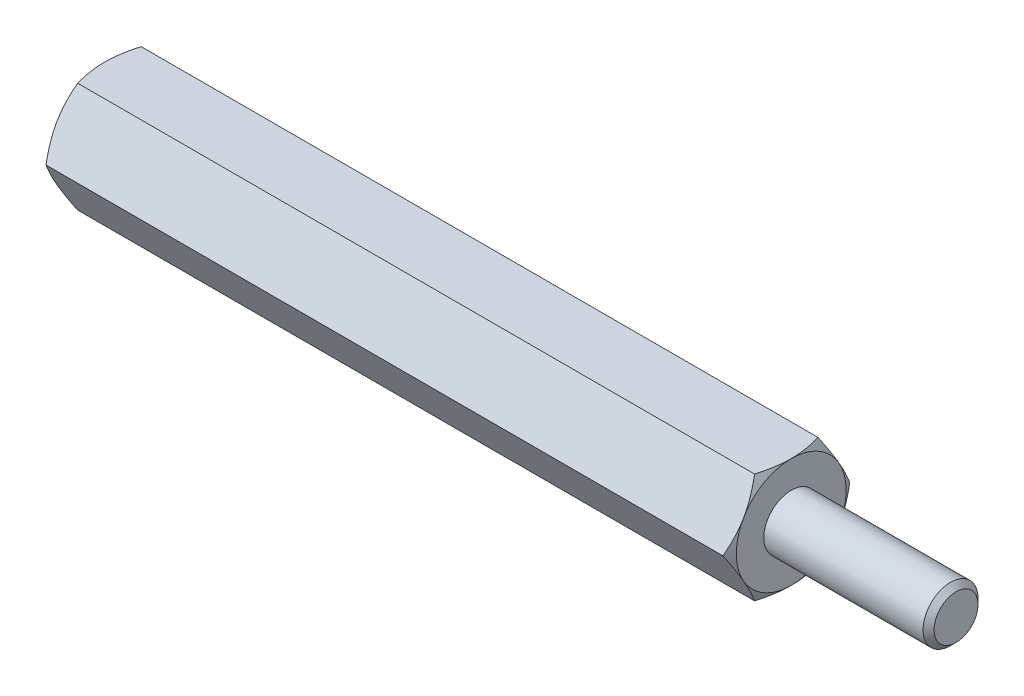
SolidWorks part; units mm, degrees
ref_plane "Front Plane" through (0, 0, 0) normal (0, 0, 1) x (1, 0, 0)
ref_plane "Top Plane" through (0, 0, 0) normal (0, 1, 0) x (1, 0, 0)
ref_plane "Right Plane" through (0, 0, 0) normal (1, 0, 0) x (0, 0, -1)
sketch "Sketch1" plane through (0, 0, 0) normal (1, 0, 0) x (0, 0, -1)
  line L1 (1.1547, 2) -> (-1.1547, 2)
  line L2 (-1.1547, 2) -> (-2.3094, 0)
  line L3 (-2.3094, 0) -> (-1.1547, -2)
  line L4 (-1.1547, -2) -> (1.1547, -2)
  line L5 (1.1547, -2) -> (2.3094, 0)
  line L6 (2.3094, 0) -> (1.1547, 2)
  circle A0 centre (0, 0) radius 2 construction
  dimension "D1" = 4
extrude "Extrude2" add sketch "Sketch1" along normal mid plane 25
sketch "Sketch2" plane through (0, 0, 0) normal (0, 0, 1) x (1, 0, 0)
  line L0 (-12.5, 2) -> (-11, 4.5981)
  line L1 (-12.5, 5) -> (-12.5, 2)
  line L3 (0, 0) -> (50000, 0) construction
  arc A0 (-11, 4.5981) -> (-12.5, 5) centre (-11.6962, 5) ccw
  dimension "D1" = 30
  dimension "D2" = 3
revolve "Cut-Revolve1" cut sketch "Sketch2" angle 360 about L3
mirror "Mirror1" about plane through (0, 0, 0) normal (1, 0, 0) of "Cut-Revolve1"
sketch "Sketch3" plane through (-12.5, 0, 0) normal (-1, 0, 0) x (0, 0, 1)
  circle A0 centre (0, 0) radius 0.8
  dimension "D1" = 1.6
extrude "Extrude3" cut sketch "Sketch3" against normal blind 6
sketch "Sketch4" plane through (0, 0, 0) normal (0, 0, 1) x (1, 0, 0)
  line L0 (-6.5, 0) -> (-6.5, 0.8)
  line L1 (12.3214, 0) -> (-12.3214, 0) construction
  line L2 (-6.5, 0.8) -> (-6.0381, 0)
  line L3 (-6.0381, 0) -> (-6.5, 0)
  line L4 (-12.5, 1) -> (-12.5, -1) construction
  point P4 (-12.5, 0)
  dimension "D1" = 30
  dimension "D2" = 0.8
  dimension "D3" = 6
revolve "Cut-Revolve2" cut sketch "Sketch4" angle 360 about L3
sketch "Sketch5" plane through (12.5, 0, 0) normal (1, 0, 0) x (0, 0, -1)
  circle A0 centre (0, 0) radius 1
  dimension "D1" = 2
extrude "Extrude4" add sketch "Sketch5" along normal blind 6
chamfer "Chamfer1" distance 0.2 angle 45 1 edges at (18.5, 0, -1)
equation "\"D2@Sketch4\" = \"D1@Sketch3\"/2"
